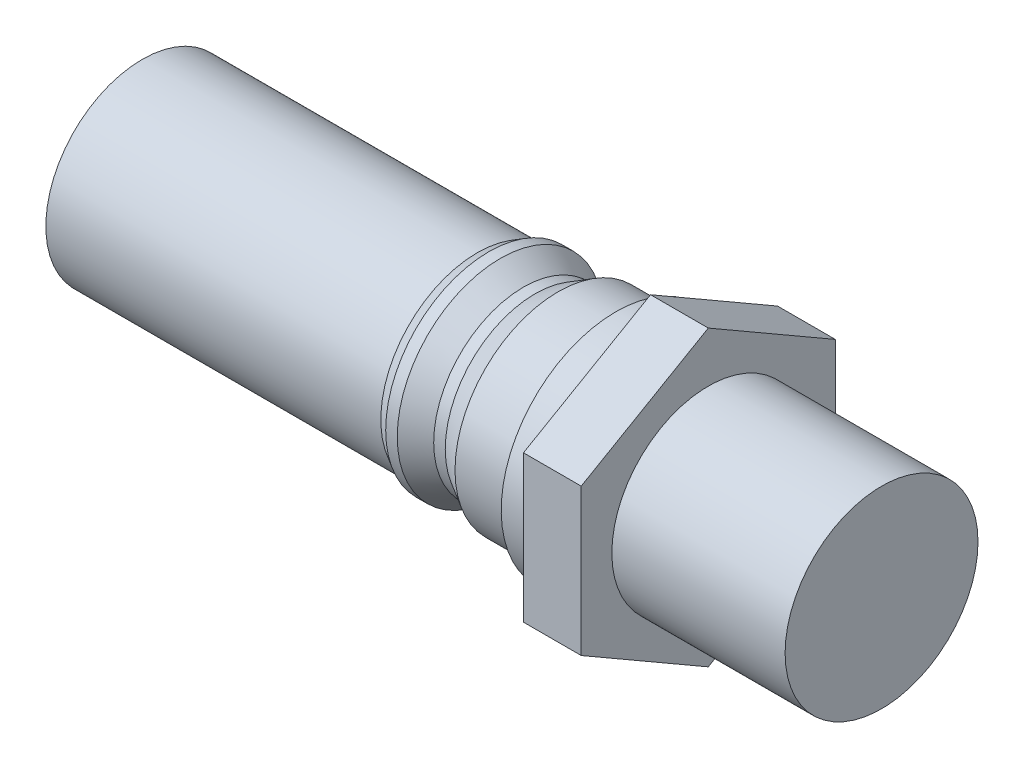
SolidWorks part; units mm, degrees
ref_plane "Alzado" through (0, 0, 0) normal (0, 0, 1) x (1, 0, 0)
ref_plane "Planta" through (0, 0, 0) normal (0, 1, 0) x (1, 0, 0)
ref_plane "Vista lateral" through (0, 0, 0) normal (1, 0, 0) x (0, 0, -1)
sketch "Croquis1" plane through (0, 0, 0) normal (0, 0, 1) x (1, 0, 0)
  line L0 (0, 0) -> (44, 0) construction
  line L1 (0, 0) -> (0, 8.35)
  line L2 (0, 8.35) -> (29, 8.35)
  line L3 (29, 8.35) -> (30, 8.9274)
  line L4 (30, 8.9274) -> (31, 8.9274)
  line L5 (30.5, 8.9274) -> (30.5, 0) construction
  line L6 (32, 8.35) -> (31, 8.9274)
  line L7 (32, 8.35) -> (33, 7.7726)
  line L8 (33, 7.7726) -> (34, 7.7726)
  line L9 (33.5, 7.7726) -> (33.5, 0) construction
  line L10 (35, 8.35) -> (34, 7.7726)
  line L11 (35, 8.35) -> (36, 8.9274)
  line L12 (36, 8.9274) -> (41, 8.9274)
  line L14 (44, 0) -> (0, 0)
  line L15 (41, 8.9274) -> (41, 9.9274)
  line L16 (41, 9.9274) -> (44, 9.9274)
  line L17 (44, 9.9274) -> (44, 0)
  point P18 (27.5743, 0)
  dimension "D1" = 16.7
  dimension "D2" = 29
  dimension "D3" = 1
  dimension "D4" = 1
  dimension "D5" = 150
  dimension "D6" = 1
  dimension "D7" = 1
  dimension "D8" = 5
  dimension "D9" = 1
  dimension "D10" = 3
revolve "Revolución1" add sketch "Croquis1" angle 360 about L14
sketch "Croquis8" plane through (44, 0, 0) normal (1, 0, 0) x (0, 0, -1)
  line L1 (0, 12.7017) -> (-11, 6.3509)
  line L2 (-11, 6.3509) -> (-11, -6.3509)
  line L3 (-11, -6.3509) -> (0, -12.7017)
  line L4 (0, -12.7017) -> (11, -6.3509)
  line L5 (11, -6.3509) -> (11, 6.3509)
  line L6 (11, 6.3509) -> (0, 12.7017)
  circle A0 centre (0, 0) radius 11 construction
  dimension "D1" = 22
extrude "Saliente-Extruir6" add sketch "Croquis8" along normal blind 5
sketch "Croquis11" plane through (0, 0, 0) normal (0, 0, 1) x (1, 0, 0)
  line L0 (49, 0) -> (52.1801, 0) construction
  line L1 (49, 6.3509) -> (49, -6.3509) construction
  line L2 (49, 0) -> (49, 8.35)
  line L3 (49, 8.35) -> (64, 8.35)
  line L4 (64, 8.35) -> (64, 0)
  line L5 (64, 0) -> (49, 0)
  dimension "D1" = 16.7
  dimension "D2" = 15
revolve "Revolución4" add sketch "Croquis11" angle 360 about L0
